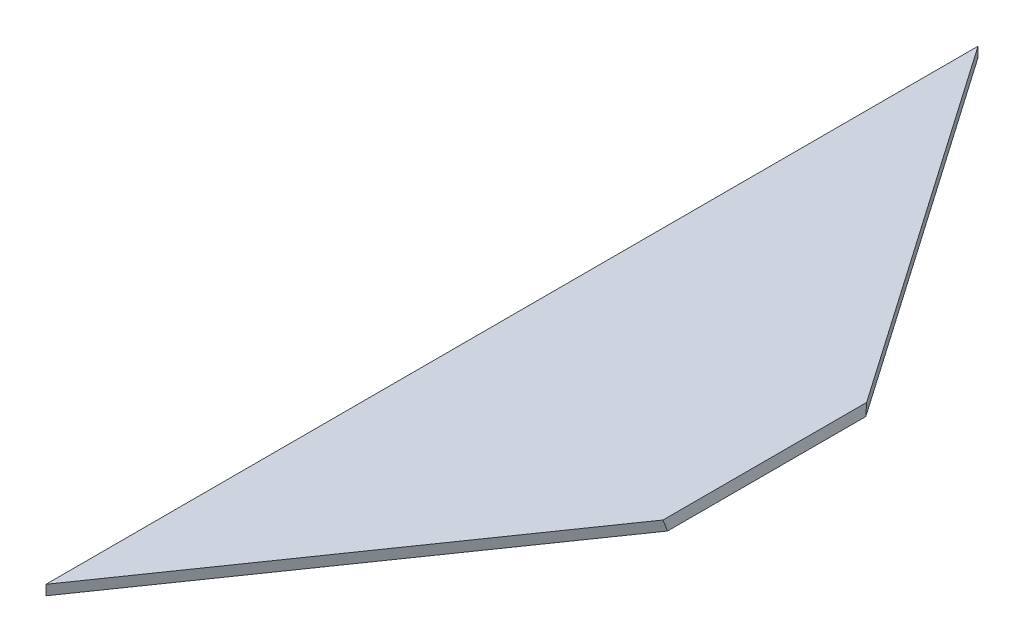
SolidWorks part; units mm, degrees
ref_plane "Vorderansicht" through (0, 0, 0) normal (0, 0, 1) x (1, 0, 0)
ref_plane "Draufsicht" through (0, 0, 0) normal (0, 1, 0) x (1, 0, 0)
ref_plane "Seitenansicht" through (0, 0, 0) normal (1, 0, 0) x (0, 0, -1)
sketch "Skizze2" plane through (0, 0, 0) normal (0, 1, 0) x (1, 0, 0)
  line L1 (0.306, 140) -> (87.1939, 14.8348)
  line L2 (0.306, 140) -> (0.306, -140)
  line L3 (87.1939, -14.8348) -> (0.306, -140)
  line L5 (87.1939, 14.8348) -> (87.1939, -14.8348)
  line L7 (0, 0) -> (183.6309, 0) construction
  line L8 (0, 0) -> (0, -149.3712) construction
  line L9 (0, -47.1625) -> (0, 47.1625) construction
  line L10 (1.5924, 140) -> (-35.1634, 140) construction
  dimension "D1" = 29.6696
  dimension "D2" = 86.8879
extrude "Linear austragen2" add sketch "Skizze2" along normal blind 3
other "Formnest1"
other "Ausfluss<1>@Behaelter1"
sketch "Skizze3" plane through (74.2257, 13.8775, 0) normal (0.983, 0.1838, 0) x (0, 0, -1)
  line L1 (-124.7172, 17.0469) -> (91.764, 17.0469)
  line L2 (-124.7172, 17.0469) -> (-124.7172, -47.7465)
  line L3 (-124.7172, -47.7465) -> (91.764, -47.7465)
  line L4 (91.764, 17.0469) -> (91.764, -47.7465)
extrude "Linear austragen3" cut sketch "Skizze3" along normal blind 45
